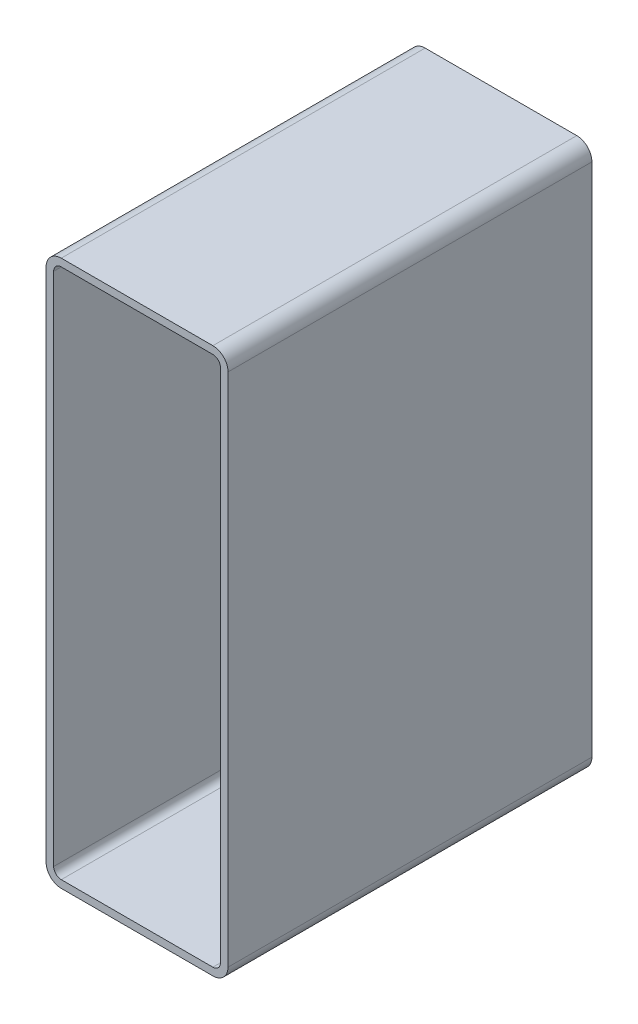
SolidWorks part; units mm, degrees
ref_plane "Front Plane" through (0, 0, 0) normal (0, 0, 1) x (1, 0, 0)
ref_plane "Top Plane" through (0, 0, 0) normal (0, 1, 0) x (1, 0, 0)
ref_plane "Right Plane" through (0, 0, 0) normal (1, 0, 0) x (0, 0, -1)
sketch "Sketch1" plane through (0, 0, 0) normal (0, 0, 1) x (1, 0, 0)
sketch_block_instance "HSS18x6x0.250-1"
sketch_block "HSS18x6x0.250"
extrude "Boss-Extrude1" add sketch "Sketch1" along normal blind 304.8
